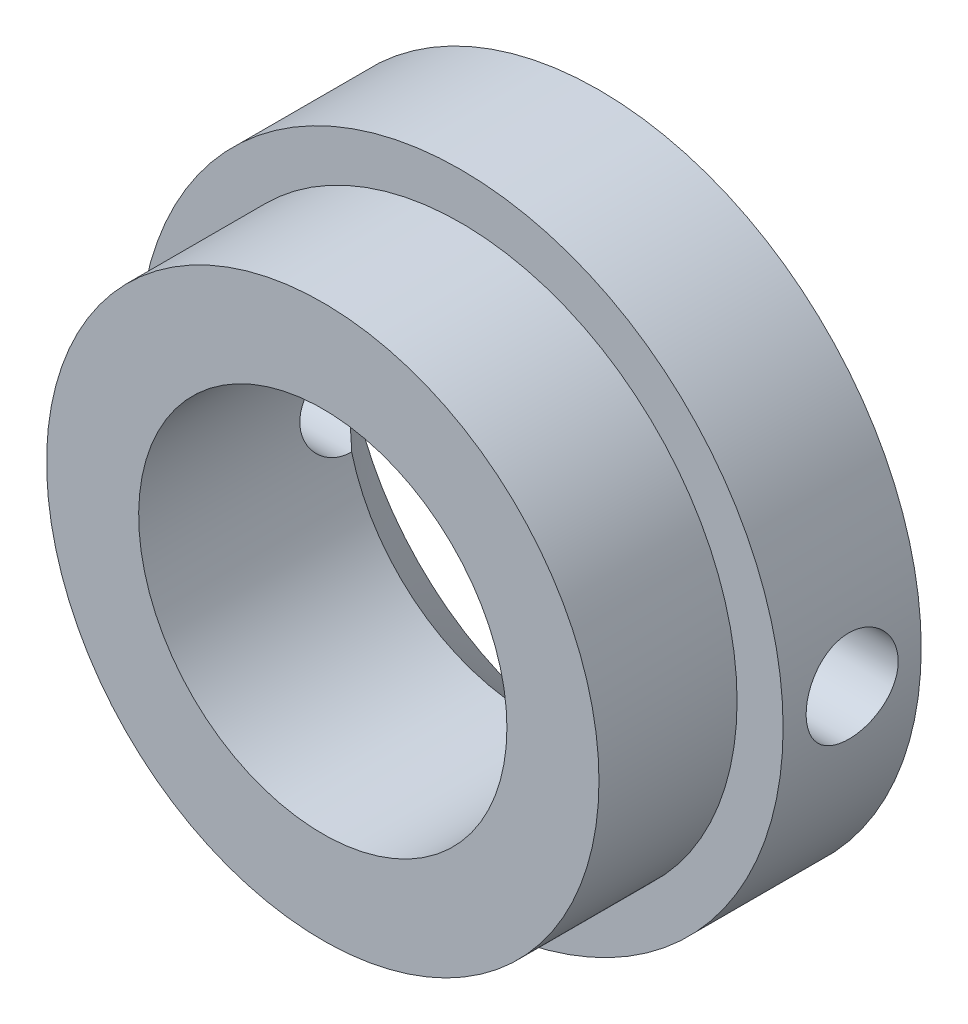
SolidWorks part; units mm, degrees
ref_plane "Front" through (0, 0, 0) normal (0, 0, 1) x (1, 0, 0)
ref_plane "Top" through (0, 0, 0) normal (0, 1, 0) x (1, 0, 0)
ref_plane "Right" through (0, 0, 0) normal (1, 0, 0) x (0, 0, -1)
sketch "Esquisse1" plane through (0, 0, 0) normal (0, 0, 1) x (1, 0, 0)
  circle A0 centre (0, 0) radius 7
  dimension "D1" = 14
extrude "Boss.-Extru.1" add sketch "Esquisse1" along normal blind 3
sketch "Esquisse2" plane through (0, 0, 3) normal (0, 0, 1) x (1, 0, 0)
  circle A0 centre (0, 0) radius 6
  dimension "D1" = 12
extrude "Boss.-Extru.2" add sketch "Esquisse2" along normal blind 3
hole_wizard "Fraisage pour vis à tête fraisée M51" positions "Esquisse4" profile "Esquisse3" countersink size "M5" standard "Ansi Metric"
sketch "Esquisse4" plane through (0, 0, 0) normal (0, 0, -1) x (-1, 0, 0)
  point P2 (0, 0)
sketch "Esquisse3" plane through (0, 0, 0) normal (1, 0, 0) x (0, 1, 0)
  line L0 (0, 0) -> (0, 6)
  line L1 (0, 6) -> (4, 6)
  line L2 (4, 6) -> (4, 1.5)
  line L3 (4, 1.5) -> (5.5, 0)
  line L5 (5.5, 0) -> (0, 0)
  line L6 (-4, 1.5) -> (-5.5, 0) construction
  line L11 (0, -6.35) -> (0, 107.95) construction
  dimension "Diamètre du perçage jusqu'au prochain" = 8
  dimension "Profondeur du perçage jusqu'au prochain" = 6
  dimension "Diamètre du fraisage entrant" = 11
  dimension "Angle du fraisage entrant" = 90
ref_plane "Plan1" through (7, 0, 0) normal (1, 0, 0) x (0, 0, -1)
hole_wizard "Diamètre du perçage Ø0.15 (0.15)1" positions "Esquisse6" profile "Esquisse5" hole size "Ø0.15" standard "Ansi Metric"
sketch "Esquisse6" plane through (7, 0, 0) normal (1, 0, 0) x (0, 0, -1)
  line L0 (0, -7) -> (0, 7) construction
  point P0 (-1.5, 0)
  dimension "D1" = 1.5
sketch "Esquisse5" plane through (7, 0, 1.5) normal (0, 1, 0) x (0, 0, -1)
  line L0 (0, 0) -> (0, 14)
  line L1 (0, 14) -> (1, 14)
  line L2 (1, 14) -> (1, 0)
  line L5 (1, 0) -> (0, 0)
  line L11 (0, -6.35) -> (0, 107.95) construction
  dimension "Diamètre du perçage jusqu'au prochain" = 2
  dimension "Profondeur du perçage jusqu'au prochain" = 14
